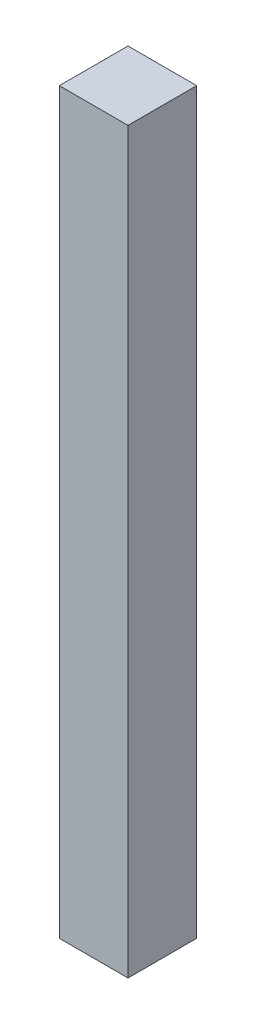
SolidWorks part; units mm, degrees
ref_plane "Plan de face" through (0, 0, 0) normal (0, 0, 1) x (1, 0, 0)
ref_plane "Plan de dessus" through (0, 0, 0) normal (0, 1, 0) x (1, 0, 0)
ref_plane "Plan de droite" through (0, 0, 0) normal (1, 0, 0) x (0, 0, -1)
sketch "Esquisse1" plane through (0, 0, 0) normal (0, 1, 0) x (1, 0, 0)
  line L1 (-33.5, 33.5) -> (33.5, 33.5)
  line L2 (-33.5, 33.5) -> (-33.5, -33.5)
  line L3 (-33.5, -33.5) -> (33.5, -33.5)
  line L4 (33.5, 33.5) -> (33.5, -33.5)
  line L5 (-33.5, 33.5) -> (33.5, -33.5) construction
  line L6 (-33.5, -33.5) -> (33.5, 33.5) construction
  point P0 (0, 0)
  dimension "D1" = 67
  dimension "D2" = 67
extrude "Boss.-Extru.1" add sketch "Esquisse1" along normal blind 720
